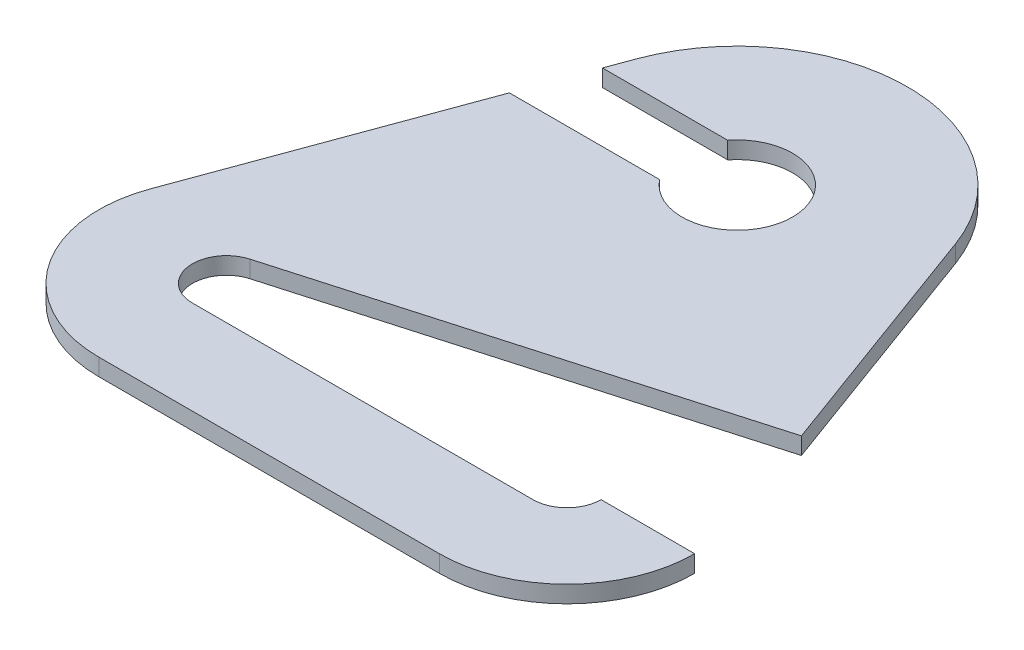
SolidWorks part; units mm, degrees
ref_plane "Front" through (0, 0, 0) normal (0, 0, 1) x (1, 0, 0)
ref_plane "Top" through (0, 0, 0) normal (0, 1, 0) x (1, 0, 0)
ref_plane "Right" through (0, 0, 0) normal (1, 0, 0) x (0, 0, -1)
sketch "Sketch1" plane through (0, 0, 0) normal (0, 1, 0) x (1, 0, 0)
  line L0 (-2.7708, 36) -> (-14.0823, 5.1661)
  line L2 (0, -15) -> (40, -15)
  line L4 (14.8765, 44) -> (0.1641, 44)
  line L5 (14.8765, 36) -> (-2.7708, 36)
  line L6 (44, 0) -> (55, 0)
  line L7 (40, -4) -> (0, -4)
  line L8 (-1.1, 3.8458) -> (49.2802, 18.2559)
  line L9 (38.7764, 46.8882) -> (49.2802, 18.2559)
  line L10 (1.2236, 46.8882) -> (0.1641, 44)
  arc A0 (-1.1, 3.8458) -> (0, -4) centre (0, 0) ccw
  arc A1 (40, -4) -> (44, 0) centre (40, 0) ccw
  arc A2 (40, -15) -> (55, 0) centre (40, 0) ccw
  arc A3 (-14.0823, 5.1661) -> (0, -15) centre (0, 0) ccw
  arc A4 (14.8765, 36) -> (14.8765, 44) centre (20, 40) ccw
  arc A5 (38.7764, 46.8882) -> (1.2236, 46.8882) centre (20, 40) ccw
extrude "Extrude1" add sketch "Sketch1" along normal blind 2
